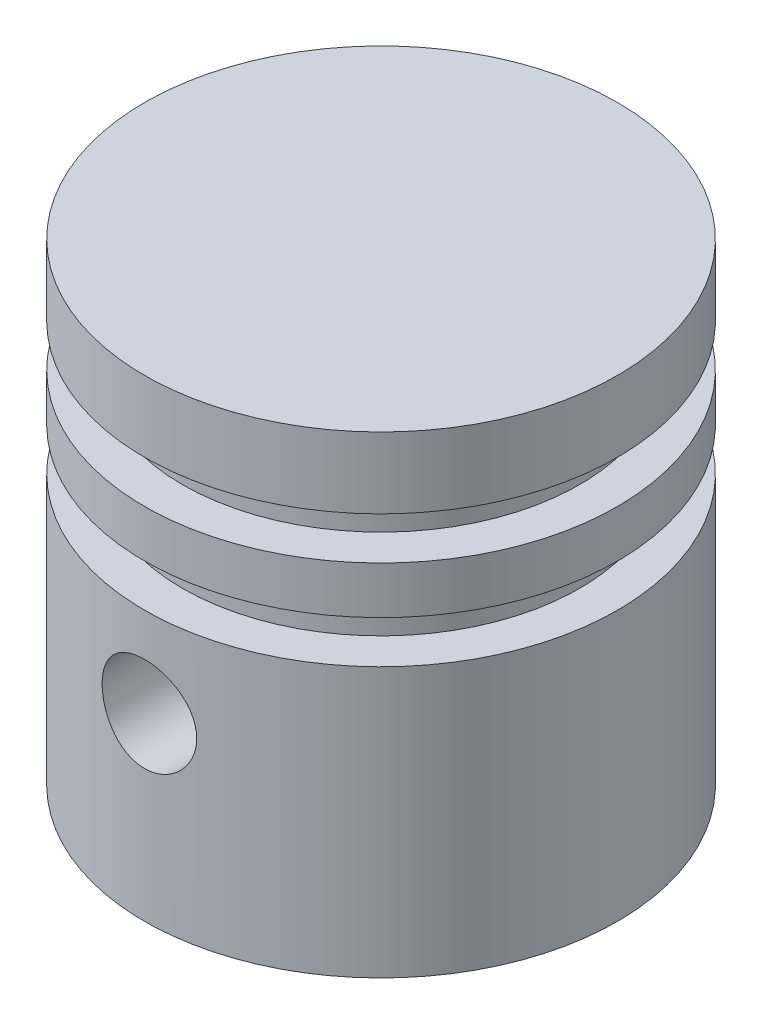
SolidWorks part; units mm, degrees
ref_plane "Płaszczyzna przednia" through (0, 0, 0) normal (0, 0, 1) x (1, 0, 0)
ref_plane "Płaszczyzna górna" through (0, 0, 0) normal (0, 1, 0) x (1, 0, 0)
ref_plane "Płaszczyzna prawa" through (0, 0, 0) normal (1, 0, 0) x (0, 0, -1)
sketch "Szkic1" plane through (0, 0, 0) normal (0, 0, 1) x (1, 0, 0)
  line L0 (0, 90) -> (0, 100)
  line L1 (0, 100) -> (50, 100)
  line L2 (50, 100) -> (50, 85)
  line L3 (50, 85) -> (42, 85)
  line L4 (42, 85) -> (42, 76)
  line L5 (42, 76) -> (50, 76)
  line L6 (50, 76) -> (50, 66)
  line L7 (50, 66) -> (42, 66)
  line L8 (42, 66) -> (42, 57)
  line L9 (42, 57) -> (50, 57)
  line L10 (50, 57) -> (50, 0)
  line L11 (50, 0) -> (35, 0)
  line L12 (35, 0) -> (35, 69)
  line L13 (35, 69) -> (27.3566, 90)
  line L14 (27.3566, 90) -> (0, 90)
  line L15 (0, 0) -> (0, 90) construction
  dimension "D1" = 100
  dimension "D2" = 100
  dimension "D3" = 15
  dimension "D4" = 10
  dimension "D5" = 9
  dimension "D6" = 8
  dimension "D7" = 15
  dimension "D8" = 69
  dimension "D9" = 110
  dimension "D10" = 10
revolve "Obrót wokół linii środkowej1" add sketch "Szkic1" angle 360 about L15
ref_plane "Płaszczyzna1" through (0, 0, 10) normal (0, 0, 1) x (1, 0, 0)
sketch "Szkic2" plane through (0, 0, 10) normal (0, 0, 1) x (1, 0, 0)
  circle A0 centre (0, 38) radius 15
  dimension "D1" = 30
  dimension "D2" = 38
extrude "Wyciągnięcie1" add sketch "Szkic2" along normal up to surface draft 20
mirror "Lustro1" about plane through (0, 0, 0) normal (0, 0, 1) of "Wyciągnięcie1"
sketch "Szkic3" plane through (0, 0, 0) normal (0, 0, 1) x (1, 0, 0)
  circle A0 centre (0, 38) radius 10
  circle A1 centre (0, 38) radius 15 construction
  dimension "D1" = 20
extrude "Wytnij-wyciągnięcie1" cut sketch "Szkic3" against normal through all and the other way through all
fillet "Zaokrąglenie1" radius 5
